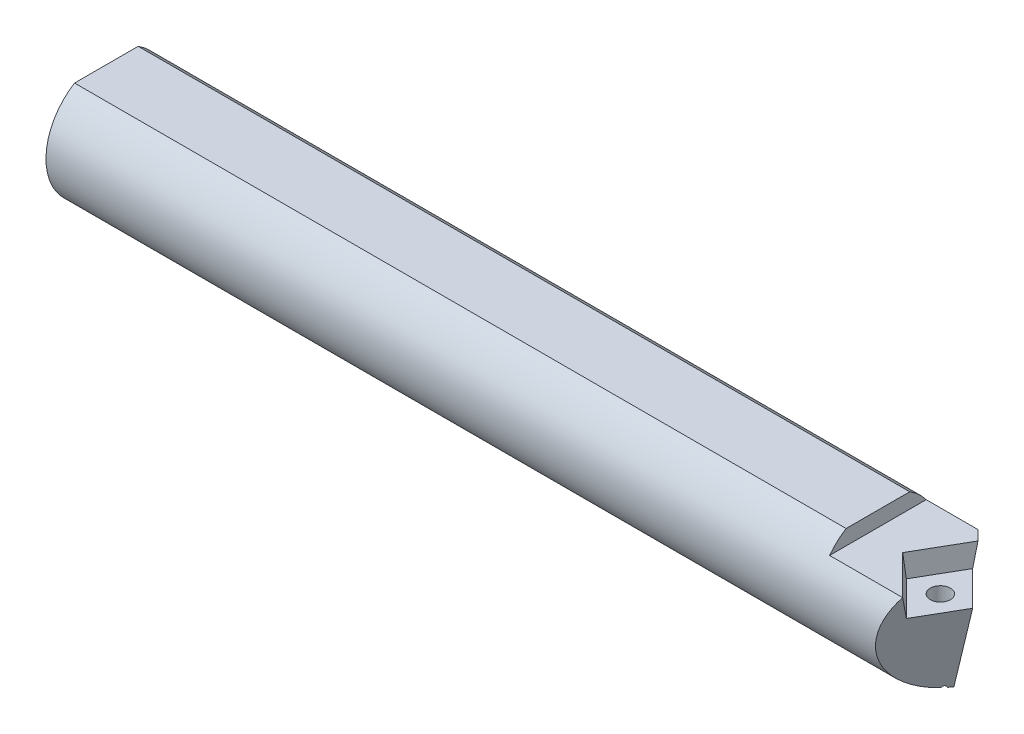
SolidWorks part; units mm, degrees
ref_plane "Front Plane" through (0, 0, 0) normal (0, 0, 1) x (1, 0, 0)
ref_plane "Top Plane" through (0, 0, 0) normal (0, 1, 0) x (1, 0, 0)
ref_plane "Right Plane" through (0, 0, 0) normal (1, 0, 0) x (0, 0, -1)
sketch "Sketch1" plane through (0, 0, 0) normal (1, 0, 0) x (0, 0, -1)
  circle A0 centre (0, 0) radius 9
  dimension "D1" = 18
extrude "Boss-Extrude1" add sketch "Sketch1" along normal mid plane 130
ref_plane "Plane1" through (0, 7.65, 0) normal (0, 1, 0) x (1, 0, 0)
sketch "Sketch2" plane through (0, 7.65, 0) normal (0, 1, 0) x (1, 0, 0)
  line L1 (-65, 9) -> (65, 9)
  line L2 (-65, 9) -> (-65, -9)
  line L3 (-65, -9) -> (65, -9)
  line L4 (65, 9) -> (65, -9)
  line L5 (-65, 9) -> (65, -9) construction
  line L6 (-65, -9) -> (65, 9) construction
  point P0 (0, 0)
  dimension "D1" = 18
  dimension "D2" = 130
extrude "Cut-Extrude1" cut sketch "Sketch2" along normal through all
sketch "Sketch3" plane through (65, 0, 0) normal (1, 0, 0) x (0, 0, -1)
  line L0 (-4.741, 7.65) -> (4.741, 7.65) construction
  line L1 (-10.3667, 5.4) -> (10.7231, 5.4)
  line L2 (-10.3667, 5.4) -> (-10.3667, 7.65)
  line L3 (-10.3667, 7.65) -> (10.7231, 7.65)
  line L4 (10.7231, 5.4) -> (10.7231, 7.65)
  dimension "D1" = 2.25
extrude "Cut-Extrude2" cut sketch "Sketch3" against normal blind 15
sketch "Sketch4" plane through (0, 5.4, 0) normal (0, 1, 0) x (1, 0, 0)
  line L0 (65, -0.0812) -> (60.89, -7.2)
  line L1 (65, -7.2) -> (65, 7.2) construction
  line L2 (60.89, -7.2) -> (55.0775, -1.3875)
  line L3 (55.0775, -1.3875) -> (59.1875, 5.7313)
  line L4 (59.1875, 5.7313) -> (65, -0.0812)
  line L5 (65, -7.2) -> (50, -7.2) construction
  circle A0 centre (60.0387, -0.7344) radius 3.97 construction
  point P8 (58.2325, -1.174)
  point P9 (51.5332, 0.324)
  point P10 (65, -0.9035)
  point P11 (59.7513, 6.0455)
  point P12 (59.7513, -7.2)
  point P15 (59.9802, 5.2549)
  point P16 (60.5211, -7.2)
  point P17 (59.9228, 5.5546)
  point P18 (60.5932, 5.4903)
  dimension "D1" = 7.94
  dimension "D2" = 75
  dimension "D3" = 75
  dimension "D4" = 45
extrude "Cut-Extrude3" cut sketch "Sketch4" against normal blind 3.18 draft 7
sketch "Sketch5" plane through (0, 2.22, 0) normal (0, 1, 0) x (1, 0, 0)
  line L0 (64.5121, -0.1454) -> (55.5654, -1.3233) construction
  circle A0 centre (60.0387, -0.7344) radius 1.5
  dimension "D1" = 3
extrude "Cut-Extrude4" cut sketch "Sketch5" against normal through all
sketch "Sketch6" plane through (0, 5.4, 0) normal (0, 1, 0) x (1, 0, 0)
  line L0 (59.1875, 5.7313) -> (70.8125, -5.8937)
  line L1 (70.8125, -5.8937) -> (70.8125, 16.113)
  line L2 (60.89, -7.2) -> (65, -0.0812)
  line L3 (70.8125, 16.113) -> (48.8058, 16.113)
  line L4 (59.1875, 5.7313) -> (48.8058, 16.113)
  line L5 (70.8125, -5.8937) -> (70.8125, -19.5413)
  line L6 (70.8125, -19.5413) -> (53.7647, -19.5413)
  line L7 (60.89, -7.2) -> (53.7647, -19.5413)
  line L9 (65, -0.0812) -> (59.1875, 5.7313) construction
  line L10 (60.89, -7.2) -> (65, -0.0812) construction
  point P8 (0, 0)
  point P11 (70.8125, -17.0555)
  point P14 (54.2017, -17.653)
  point P15 (51.7532, -18.1361)
extrude "Cut-Extrude5" cut sketch "Sketch6" against normal through all draft 10 contours L2 L7 L6 L5 L0 | L4 L0 L1 L3 M12 M11 | L4 M10 M11 M12
